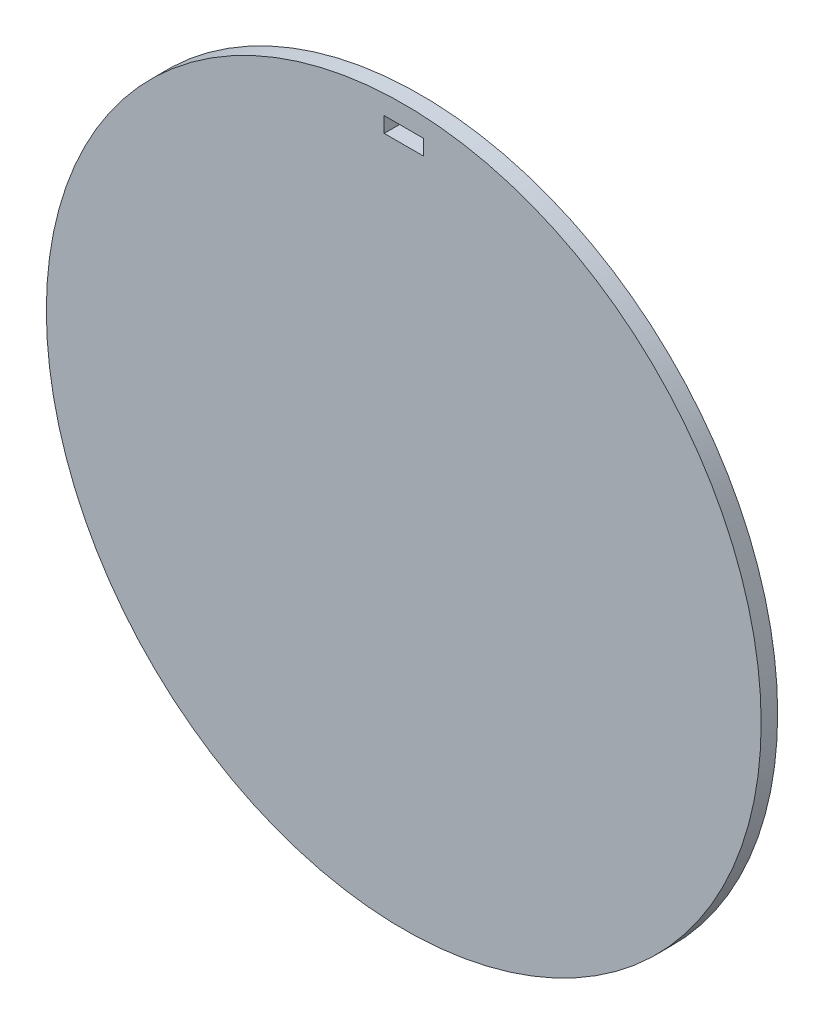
SolidWorks part; units mm, degrees
ref_plane "Front Plane" through (0, 0, 0) normal (0, 0, 1) x (1, 0, 0)
ref_plane "Top Plane" through (0, 0, 0) normal (0, 1, 0) x (1, 0, 0)
ref_plane "Right Plane" through (0, 0, 0) normal (1, 0, 0) x (0, 0, -1)
sketch "Sketch1" plane through (0, 0, 0) normal (0, 0, 1) x (1, 0, 0)
  line L0 (-3.554, 58.6) -> (-3.554, 61.4)
  line L7 (-3.654, 58.5) -> (3.654, 58.5) construction
  line L8 (-3.654, 58.5) -> (-3.654, 61.5) construction
  line L9 (-3.654, 61.5) -> (3.654, 61.5) construction
  line L10 (3.654, 58.5) -> (3.654, 61.5) construction
  line L11 (-3.654, 58.5) -> (3.654, 61.5) construction
  line L12 (-3.654, 61.5) -> (3.654, 58.5) construction
  line L13 (-3.554, 61.4) -> (3.554, 61.4)
  line L14 (3.554, 58.6) -> (3.554, 61.4)
  line L15 (-3.554, 58.6) -> (3.554, 58.6)
  circle A0 centre (0, 0) radius 65
  point P0 (0, 0)
  point P5 (0, 60)
  point P52 (0, 0)
  point P73 (0, 0)
extrude "Boss-Extrude1" add sketch "Sketch1" along normal blind 3
equation "\"Thick\"= 3"
equation "\"h\"= 3"
equation "\"kerf\"= .2"
equation "\"Length\"= \"Thick\""
equation "\"Deflection\"= .4 * \"Thick\""
equation "\"Strain\"= \"Deflection\" / \"Length\""
equation "\"Per_def\"= 1.09 * ( \"Strain\" * \"Length\" * \"Length\" ) / \"h\""
equation "\"D1@Sketch1\"=((\"Per_def\"*.5)+\"h\")*2"
equation "\"D2@Sketch1\"=\"Thick\""
equation "\"D5@Sketch1\"=\"kerf\"/2"
equation "\"D1@Boss-Extrude1\"=\"Thick\""
equation "\"circulo_ext\"=130"
equation "\"dist_corte_ext\"=60"
equation "\"D3@Sketch1\"=\"dist_corte_ext\""
equation "\"circulo_interno\"= \"circulo_ext\" - ( ( \"circulo_ext\" / 5 ) * 2 )"
